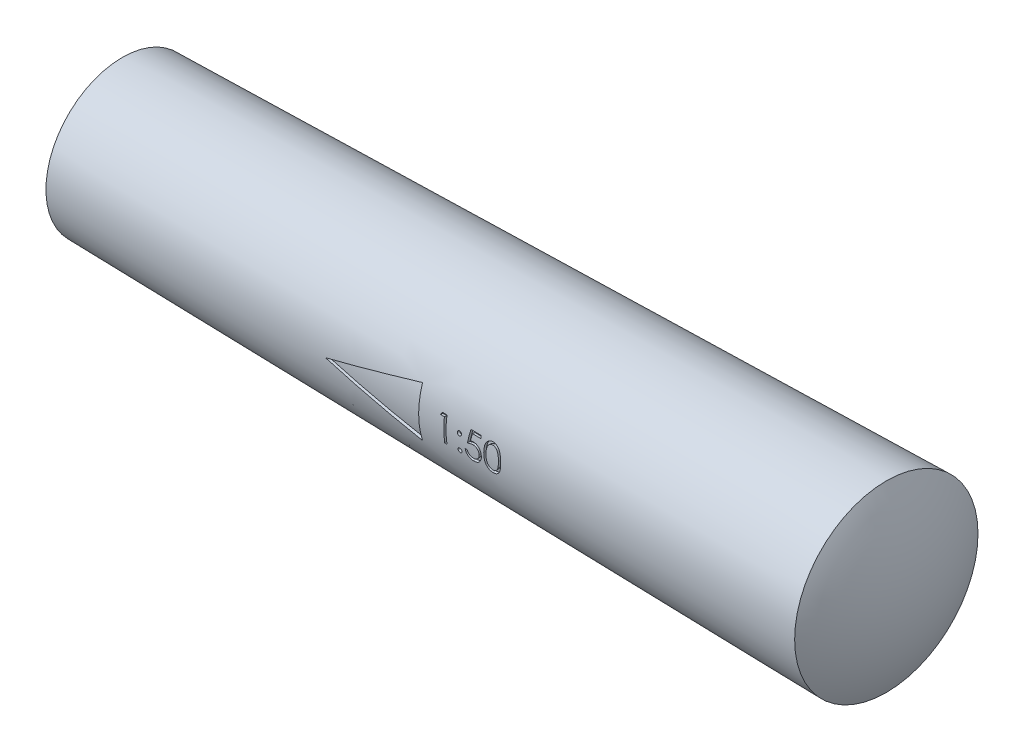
SolidWorks part; units mm, degrees
ref_plane "Front Plane" through (0, 0, 0) normal (0, 0, 1) x (1, 0, 0)
ref_plane "Top Plane" through (0, 0, 0) normal (0, 1, 0) x (1, 0, 0)
ref_plane "Right Plane" through (0, 0, 0) normal (1, 0, 0) x (0, 0, -1)
sketch "Sketch1" plane through (0, 0, 0) normal (1, 0, 0) x (0, 0, -1)
  circle A0 centre (0, 0) radius 3
  dimension "D1" = 6
extrude "Extrude1" add sketch "Sketch1" along normal mid plane 30
draft "Draft1" type of draft neutral plane draft angle 1.146 faces to draft 1 parameters "D1"=1.146
sketch "Sketch2" plane through (0, 0, 0) normal (0, 0, 1) x (1, 0, 0)
  line L0 (-15, 0) -> (-15, 3)
  line L1 (-15, 3) -> (-15, -3) construction
  line L2 (-15, 0) -> (-15.9, 0)
  line L3 (-15.9, 0) -> (-15.9, -3.3) construction
  line L4 (15, 0) -> (15, 3.6)
  line L5 (15, -3.6) -> (15, 3.6) construction
  line L6 (15, 0) -> (15.9, 0)
  line L7 (15.9, 0) -> (15.9, -3.3) construction
  line L8 (-15, -3) -> (15, -3.6) construction
  arc A0 (-15.9, 0) -> (-15, 3) centre (-10.45, 0) cw
  arc A1 (15.9, 0) -> (15, 3.6) centre (8.2499, 0) ccw
  point P14 (0, -3.3)
revolve "Revolve1" add sketch "Sketch2" angle 360 about L2
sketch "Sketch5" plane through (0, 0, 0) normal (0, 0, 1) x (1, 0, 0)
  line L0 (0, 3.3) -> (0, -3.3) construction
  line L1 (15, 3.6) -> (-15, 3) construction
  line L2 (-15, -3) -> (15, -3.6) construction
ref_plane "Plane2" through (0, 0, 0) normal (-0.02, 0, 0.9998) x (0.9998, 0, 0.02)
sketch "Sketch6" plane through (0, 0, 0) normal (-0.02, 0, 0.9998) x (0.9998, 0, 0.02)
  line L0 (0, 0) -> (0, 1)
  line L1 (0, 3.3) -> (0, -3.3) construction
  line L2 (0, 1) -> (-3.7321, 0)
  line L3 (-3.7321, 0) -> (0, -1)
  line L4 (0, -1) -> (0, 0)
  line L5 (0, -0.5) -> (4, -0.5) construction
  text T0 "1:50" font "Century Gothic" height 1
  dimension "D1" = 2
  dimension "D2" = 30
  dimension "D3" = 4
wrap "Wrap2" sketch "Sketch6" wrap type deboss source sketch "Sketch6" thickness 0.1 parameters "D1"=0.1
equation "\"D2@Sketch2\" = \"D1@Sketch2\""
